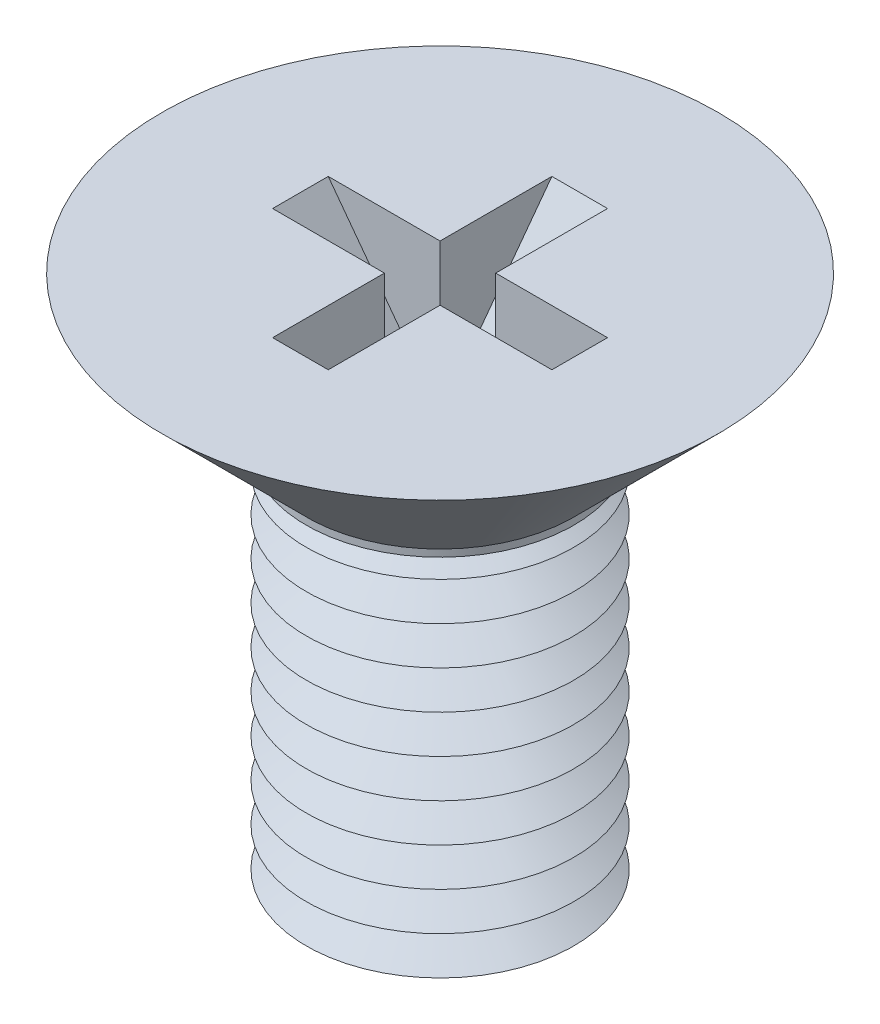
SolidWorks part; units mm, degrees
ref_plane "Front" through (0, 0, 0) normal (0, 0, 1) x (1, 0, 0)
ref_plane "Top" through (0, 0, 0) normal (0, 1, 0) x (1, 0, 0)
ref_plane "Side" through (0, 0, 0) normal (1, 0, 0) x (0, 0, -1)
sketch "Sketch1" plane through (0, 0, 0) normal (0, 0, 1) x (1, 0, 0)
  line L0 (0, 0) -> (2.5, 0)
  line L1 (2.5, 0) -> (5.2, 2.7)
  line L2 (5.2, 2.7) -> (0, 2.7)
  line L3 (0, 2.7) -> (0, 0)
  line L4 (0, 0) -> (0, 100) construction
revolve "Base-Revolve" add sketch "Sketch1" angle 360 about L4
sketch "Sketch2" plane through (0, 0, 0) normal (0, 0, 1) x (1, 0, 0)
  line L0 (0, 0) -> (0, 100) construction
  line L1 (0, -7.3) -> (1.8792, -7.3)
  line L2 (1.8792, -7.3) -> (2.5, -6.9416)
  line L3 (2.5, -6.9416) -> (1.8792, -6.5832)
  line L4 (1.8792, -6.5832) -> (2.5, -6.2248)
  line L5 (2.5, -6.2248) -> (1.8792, -5.8664)
  line L6 (1.8792, -5.8664) -> (2.5, -5.508)
  line L7 (2.5, -5.508) -> (1.8792, -5.1496)
  line L8 (1.8792, -5.1496) -> (2.5, -4.7912)
  line L9 (2.5, -4.7912) -> (1.8792, -4.4328)
  line L10 (1.8792, -4.4328) -> (2.5, -4.0744)
  line L11 (2.5, -4.0744) -> (1.8792, -3.716)
  line L12 (1.8792, -3.716) -> (2.5, -3.3575)
  line L13 (2.5, -3.3575) -> (1.8792, -2.9991)
  line L14 (1.8792, -2.9991) -> (2.5, -2.6407)
  line L15 (2.5, -2.6407) -> (1.8792, -2.2823)
  line L16 (1.8792, -2.2823) -> (2.5, -1.9239)
  line L17 (2.5, -1.9239) -> (1.8792, -1.5655)
  line L18 (1.8792, -1.5655) -> (2.5, -1.2071)
  line L19 (2.5, -1.2071) -> (1.8792, -0.8487)
  line L20 (1.8792, -0.8487) -> (2.5, -0.4903)
  line L21 (2.5, -0.4903) -> (1.8792, -0.1319)
  line L22 (1.8792, -0.1319) -> (2.5, -0.1319)
  line L23 (2.5, -0.1319) -> (2.5, 0)
  line L24 (2.5, 0) -> (0, 0)
  line L25 (0, 0) -> (0, -7.3)
revolve "Boss-Revolve1" add sketch "Sketch2" angle 360 about L0
sketch "Sketch3" plane through (0, 0, 0) normal (0, 0, 1) x (1, 0, 0)
  line L0 (-2.61, 4.05) -> (2.61, 4.05)
  line L1 (2.61, 4.05) -> (2.61, 2.7)
  line L2 (2.61, 2.7) -> (0, -0.8)
  line L3 (0, -0.8) -> (-2.61, 2.7)
  line L4 (-2.61, 2.7) -> (-2.61, 4.05)
extrude "Cut-Extrude1" cut sketch "Sketch3" against normal mid plane 1.04
sketch "Sketch4" plane through (0, 0, 0) normal (1, 0, 0) x (0, 0, -1)
  line L0 (-2.61, 4.05) -> (2.61, 4.05)
  line L1 (2.61, 4.05) -> (2.61, 2.7)
  line L2 (2.61, 2.7) -> (0, -0.8)
  line L3 (0, -0.8) -> (-2.61, 2.7)
  line L4 (-2.61, 2.7) -> (-2.61, 4.05)
extrude "Cut-Extrude2" cut sketch "Sketch4" against normal mid plane 1.04
